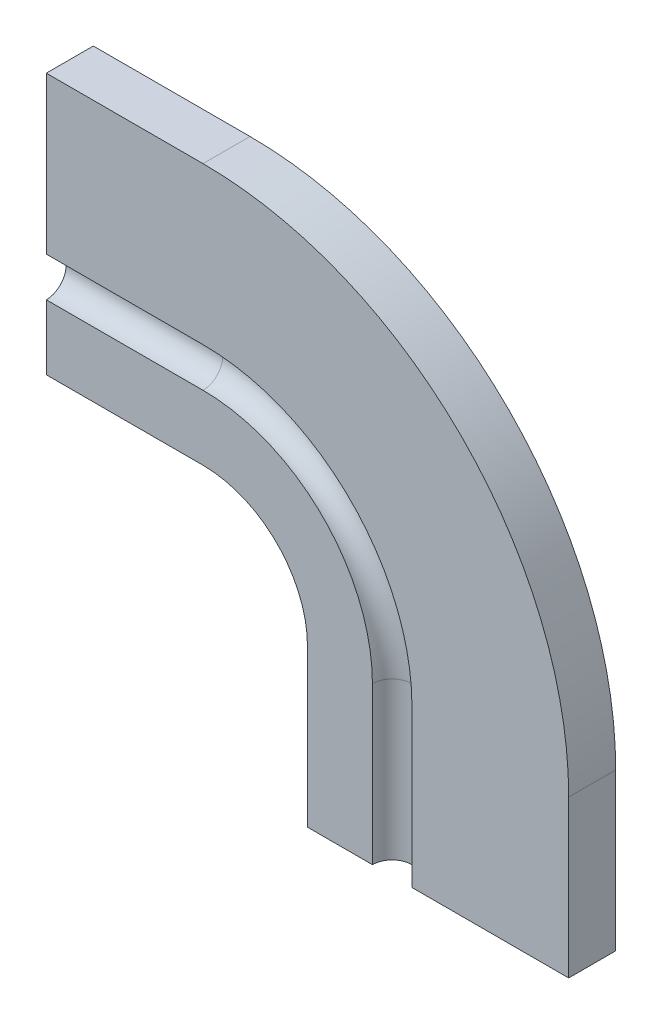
SolidWorks part; units mm, degrees
ref_plane "Front Plane" through (0, 0, 0) normal (0, 0, 1) x (1, 0, 0)
ref_plane "Top Plane" through (0, 0, 0) normal (0, 1, 0) x (1, 0, 0)
ref_plane "Right Plane" through (0, 0, 0) normal (1, 0, 0) x (0, 0, -1)
sketch "Sketch1" plane through (0, 0, 0) normal (0, 0, 1) x (1, 0, 0)
  line L0 (0, 0) -> (0, 50) construction
  line L1 (0, 50) -> (30, 50) construction
  line L2 (100, -20) -> (100, -50) construction
  line L3 (100, -50) -> (50, -50) construction
  line L4 (50, -50) -> (50, -20)
  line L5 (30, 0) -> (0, 0)
  arc A0 (30, 50) -> (100, -20) centre (30, -20) cw construction
  arc A1 (50, -20) -> (30, 0) centre (30, -20) ccw
  dimension "D2" = 50
  dimension "D3" = 20
  dimension "D1" = 30
sketch "Sketch2" plane through (0, 0, 0) normal (1, 0, 0) x (0, 0, -1)
  line L0 (-9, 50) -> (0, 50) construction
  line L1 (0, 0) -> (0, 12.428)
  line L2 (-1.1132, 48.8101) -> (-1.1132, 21.0885) construction
  line L3 (-9, 0) -> (0, 0) construction
  line L5 (0, 20) -> (0, 50)
  line L6 (9, 50) -> (9, 48.786)
  line L7 (9, 48.786) -> (1.214, 48.786)
  line L8 (1.214, 11.3636) -> (1.214, 1.214)
  line L9 (1.214, 1.214) -> (9, 1.214)
  line L10 (9, 1.214) -> (9, 0)
  line L11 (1.214, 48.786) -> (1.214, 21.0644)
  line L12 (-9, 1.214) -> (-9, 0) construction
  line L13 (-1.214, 1.214) -> (-9, 1.214) construction
  line L14 (-1.214, 11.3636) -> (-1.214, 1.214) construction
  line L15 (-9, 48.786) -> (-1.1132, 48.8101) construction
  line L16 (-9, 50) -> (-9, 48.786) construction
  line L17 (9, 50) -> (0, 50)
  line L18 (9, 0) -> (0, 0)
  line L19 (0, 0) -> (0, 50) construction
  arc A0 (0, 12.428) -> (0, 20) centre (0, 16.214) ccw
  arc A1 (1.214, 21.0644) -> (1.214, 11.3636) centre (0, 16.214) cw
  arc A2 (-1.1132, 21.0885) -> (-1.214, 11.3636) centre (0, 16.214) ccw construction
  arc A3 (0, 12.428) -> (0, 20) centre (0, 16.214) cw construction
  dimension "D6" = 5
  dimension "D5" = 15
  dimension "D8" = 1.214
  dimension "D7" = 50
  dimension "D1" = 9
  dimension "D2" = 1.214
  dimension "D3" = 1.214
  dimension "D4" = 1.214
sweep "Sweep1" add profiles "Sketch2" path "Sketch1"
